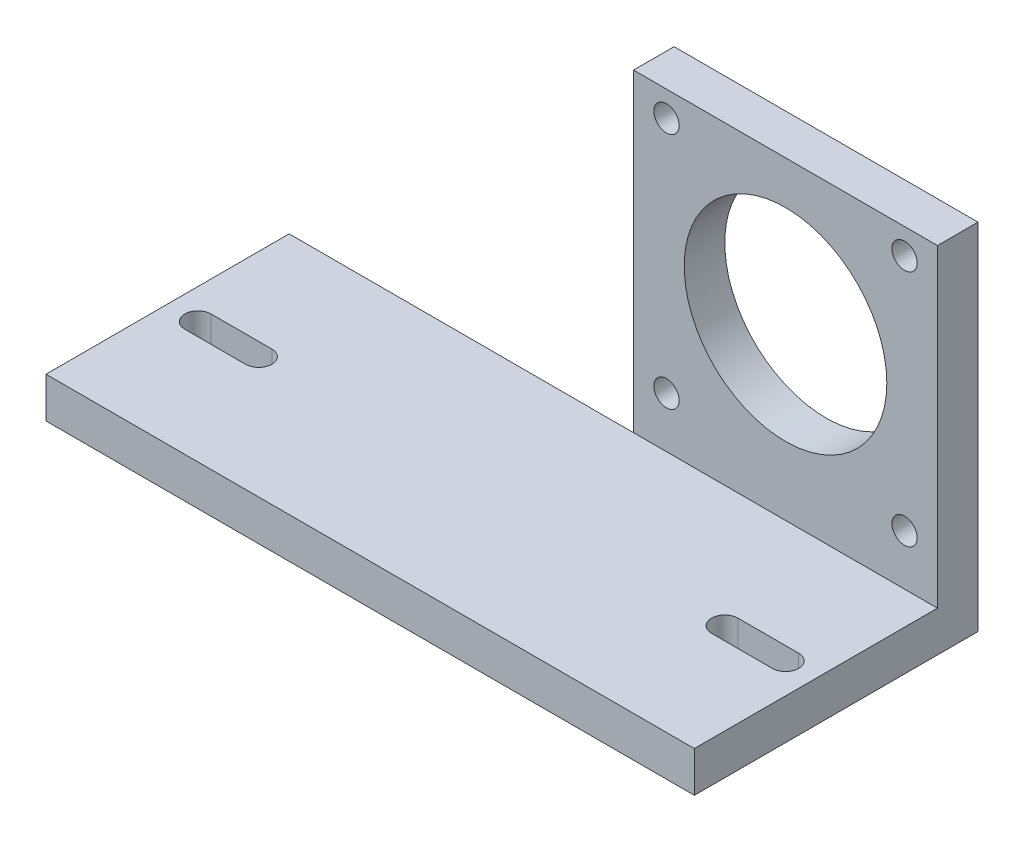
SolidWorks part; units mm, degrees
ref_plane "Спереди" through (0, 0, 0) normal (0, 0, 1) x (1, 0, 0)
ref_plane "Сверху" through (0, 0, 0) normal (0, 1, 0) x (1, 0, 0)
ref_plane "Справа" through (0, 0, 0) normal (1, 0, 0) x (0, 0, -1)
sketch "Эскиз1" plane through (0, 0, 0) normal (0, 0, 1) x (1, 0, 0)
  line L0 (0, 0) -> (-65.3166, 0) construction
  line L1 (-30, 28.5) -> (30, 28.5)
  line L2 (-30, 28.5) -> (-30, -41.5)
  line L3 (-30, -41.5) -> (30, -41.5)
  line L4 (30, 28.5) -> (30, -41.5)
  line L5 (0, 0) -> (0, -28.9273) construction
  circle A0 centre (-23.5, 23.5) radius 2.5
  circle A1 centre (23.5, 23.5) radius 2.5
  circle A2 centre (-23.5, -23.5) radius 2.5
  circle A3 centre (23.5, -23.5) radius 2.5
  circle A4 centre (0, 0) radius 20
extrude "Бобышка-Вытянуть1" add sketch "Эскиз1" along normal blind 8
sketch "Эскиз2" plane through (0, 0, 8) normal (0, 0, 1) x (1, 0, 0)
  line L0 (30, -41.5) -> (30, 28.5) construction
  line L1 (-98, -41.5) -> (30, -41.5)
  line L2 (-98, -41.5) -> (-98, -33.5)
  line L3 (-98, -33.5) -> (30, -33.5)
  line L4 (30, -41.5) -> (30, -33.5)
  point P7 (0, 0)
  point P8 (0, 0)
  point P9 (-62.5786, -38.1726)
  point P10 (30, -41.5)
  dimension "D1" = 8
  dimension "D2" = 128
extrude "Бобышка-Вытянуть2" add sketch "Эскиз2" along normal blind 48
sketch "Эскиз3" plane through (0, -33.5, 0) normal (0, 1, 0) x (1, 0, 0)
  line L1 (-92, -29.4) -> (-80, -29.4)
  line L2 (-98, -56) -> (-98, -8) construction
  line L3 (-92, -34.6) -> (-80, -34.6)
  line L4 (-98, -32) -> (50.7094, -32) construction
  line L5 (-98, -56) -> (-98, -8) construction
  line L6 (-34, -56) -> (-34, -17.0512) construction
  line L7 (30, -56) -> (-98, -56) construction
  line L8 (24, -34.6) -> (12, -34.6)
  line L9 (24, -29.4) -> (12, -29.4)
  arc A0 (-92, -29.4) -> (-92, -34.6) centre (-92, -32) ccw
  arc A1 (-80, -29.4) -> (-80, -34.6) centre (-80, -32) cw
  arc A2 (12, -29.4) -> (12, -34.6) centre (12, -32) ccw
  arc A3 (24, -29.4) -> (24, -34.6) centre (24, -32) cw
  dimension "D4" = 6
  dimension "D2" = 2.6
  dimension "D1" = 12
extrude "Вырез-Вытянуть1" cut sketch "Эскиз3" against normal through all
equation "\"D7@Эскиз1\"=\"D6@Эскиз1\""
